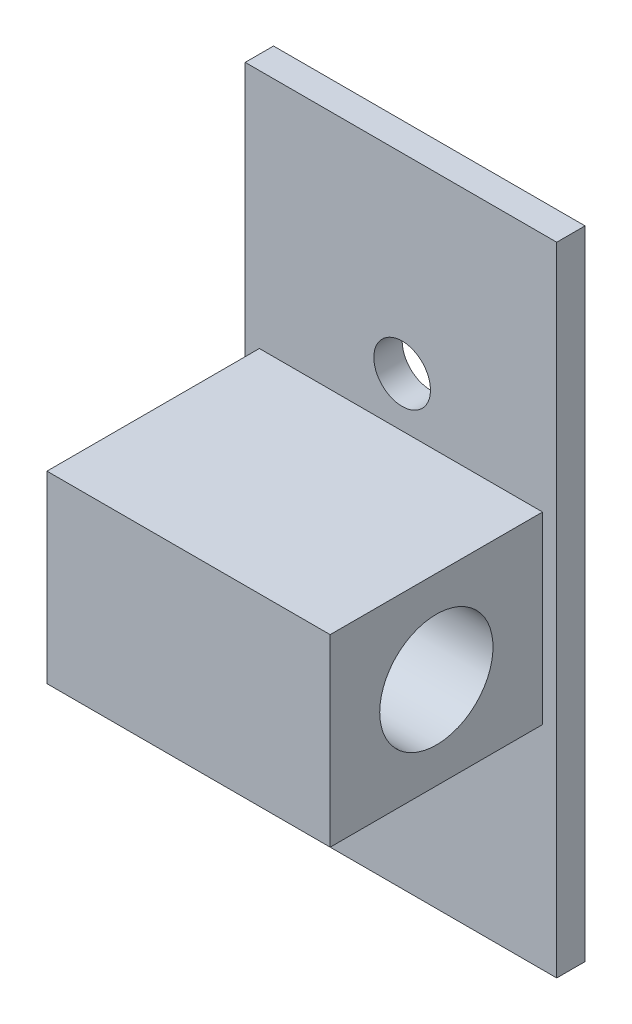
SolidWorks part; units mm, degrees
ref_plane "Front Plane" through (0, 0, 0) normal (0, 0, 1) x (1, 0, 0)
ref_plane "Top Plane" through (0, 0, 0) normal (0, 1, 0) x (1, 0, 0)
ref_plane "Right Plane" through (0, 0, 0) normal (1, 0, 0) x (0, 0, -1)
sketch "Sketch1" plane through (0, 0, 0) normal (0, 0, 1) x (1, 0, 0)
  line L1 (0, 0) -> (20, 0)
  line L2 (0, 0) -> (0, 13)
  line L3 (0, 13) -> (20, 13)
  line L4 (20, 0) -> (20, 13)
  dimension "D1" = 20
  dimension "D2" = 13
extrude "Boss-Extrude1" add sketch "Sketch1" along normal blind 15
sketch "Sketch2" plane through (0, 0, 0) normal (-1, 0, 0) x (0, 0, 1)
  line L0 (15, 13) -> (0, 13) construction
  line L1 (0, 13) -> (0, 0) construction
  circle A0 centre (7.5, 6.5) radius 4
  point P2 (7.5, 13)
  dimension "D1" = 8
  dimension "D2" = 6.5
  dimension "D3" = 7.5
extrude "Cut-Extrude1" cut sketch "Sketch2" against normal blind 26
sketch "Sketch3" plane through (0, 0, 0) normal (0, 0, -1) x (-1, 0, 0)
  line L0 (0, 13) -> (0, 0) construction
  line L1 (-21, 30) -> (1, 30)
  line L2 (-21, 30) -> (-21, -15)
  line L3 (-21, -15) -> (1, -15)
  line L4 (1, 30) -> (1, -15)
  line L5 (-20, 0) -> (-20, 13) construction
  line L7 (0, 0) -> (-20, 0) construction
  circle A0 centre (-10.0844, 16.5) radius 2
  circle A1 centre (-10.0844, -3.5) radius 2
  dimension "D6" = 4
  dimension "D9" = 4
  dimension "D1" = 1
  dimension "D2" = 1
  dimension "D3" = 3.5
  dimension "D4" = 15
  dimension "D5" = 20
extrude "Boss-Extrude2" add sketch "Sketch3" along normal blind 2
